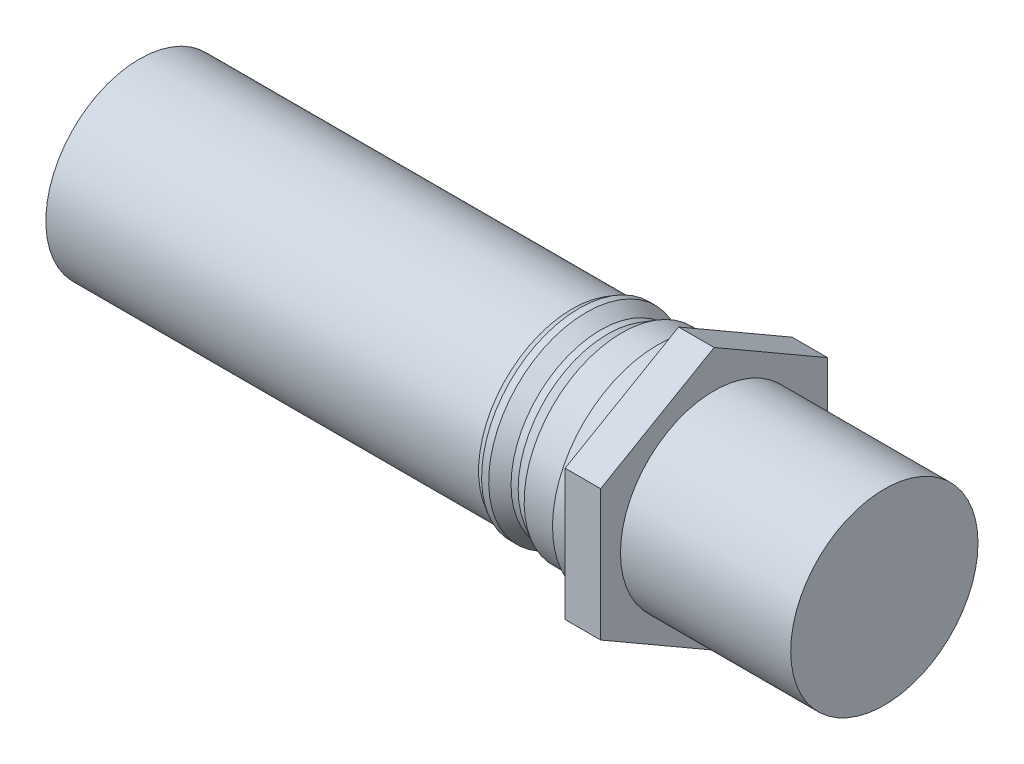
SolidWorks part; units mm, degrees
ref_plane "Alzado" through (0, 0, 0) normal (0, 0, 1) x (1, 0, 0)
ref_plane "Planta" through (0, 0, 0) normal (0, 1, 0) x (1, 0, 0)
ref_plane "Vista lateral" through (0, 0, 0) normal (1, 0, 0) x (0, 0, -1)
sketch "Croquis1" plane through (0, 0, 0) normal (0, 0, 1) x (1, 0, 0)
  line L0 (0, 0) -> (76, 0) construction
  line L1 (0, 0) -> (0, 13.2)
  line L2 (0, 13.2) -> (61, 13.2)
  line L3 (61, 13.2) -> (62, 13.7774)
  line L4 (62, 13.7774) -> (63, 13.7774)
  line L5 (62.5, 13.7774) -> (62.5, 0) construction
  line L6 (64, 13.2) -> (63, 13.7774)
  line L7 (64, 13.2) -> (65, 12.6226)
  line L8 (65, 12.6226) -> (66, 12.6226)
  line L9 (65.5, 12.6226) -> (65.5, 0) construction
  line L10 (67, 13.2) -> (66, 12.6226)
  line L11 (67, 13.2) -> (68, 13.7774)
  line L12 (68, 13.7774) -> (73, 13.7774)
  line L14 (76, 0) -> (0, 0)
  line L15 (73, 13.7774) -> (73, 14.7774)
  line L16 (73, 14.7774) -> (76, 14.7774)
  line L17 (76, 14.7774) -> (76, 0)
  point P18 (27.5743, 0)
  dimension "D1" = 26.4
  dimension "D2" = 61
  dimension "D3" = 1
  dimension "D4" = 1
  dimension "D5" = 150
  dimension "D6" = 1
  dimension "D7" = 1
  dimension "D8" = 5
  dimension "D9" = 1
  dimension "D10" = 3
revolve "Revolución1" add sketch "Croquis1" angle 360 about L14
sketch "Croquis8" plane through (76, 0, 0) normal (1, 0, 0) x (0, 0, -1)
  line L1 (0, 18.4752) -> (-16, 9.2376)
  line L2 (-16, 9.2376) -> (-16, -9.2376)
  line L3 (-16, -9.2376) -> (0, -18.4752)
  line L4 (0, -18.4752) -> (16, -9.2376)
  line L5 (16, -9.2376) -> (16, 9.2376)
  line L6 (16, 9.2376) -> (0, 18.4752)
  circle A0 centre (0, 0) radius 16 construction
  dimension "D1" = 32
extrude "Saliente-Extruir6" add sketch "Croquis8" along normal blind 5
sketch "Croquis11" plane through (0, 0, 0) normal (0, 0, 1) x (1, 0, 0)
  line L0 (81, 0) -> (52.1801, 0) construction
  line L1 (81, 9.2376) -> (81, -9.2376) construction
  line L2 (81, 0) -> (81, 13.2)
  line L3 (81, 13.2) -> (105, 13.2)
  line L4 (105, 13.2) -> (105, 0)
  line L5 (105, 0) -> (81, 0)
  dimension "D1" = 26.4
  dimension "D2" = 24
revolve "Revolución4" add sketch "Croquis11" angle 360 about L0
